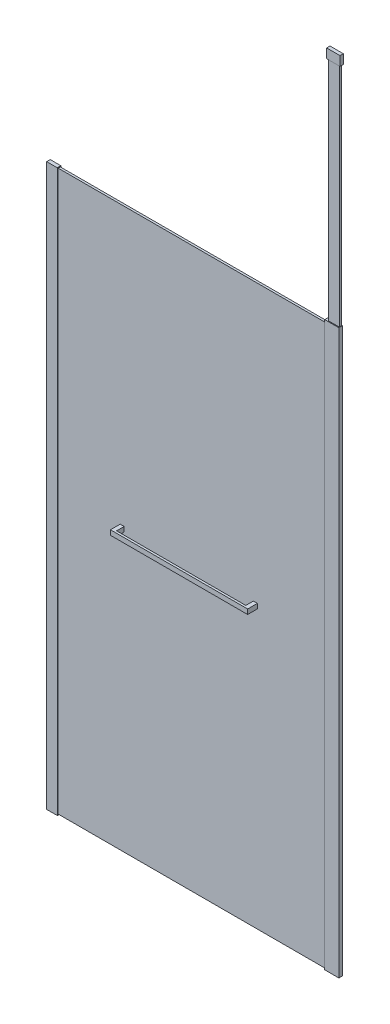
SolidWorks part; units mm, degrees
ref_plane "Płaszczyzna przednia" through (0, 0, 0) normal (0, 0, 1) x (1, 0, 0)
ref_plane "Płaszczyzna górna" through (0, 0, 0) normal (0, 1, 0) x (1, 0, 0)
ref_plane "Płaszczyzna prawa" through (0, 0, 0) normal (1, 0, 0) x (0, 0, -1)
sketch "Szkic1" plane through (0, 0, 0) normal (0, 1, 0) x (1, 0, 0)
  line L0 (0, 0) -> (0, 13.3)
  line L1 (0, 13.3) -> (40, 13.3)
  line L2 (40, 13.3) -> (40, 11.4)
  line L3 (40, 11.4) -> (6.5, 11.4)
  line L4 (6.5, 11.4) -> (6.5, 3.4)
  line L5 (6.5, 3.4) -> (40, 3.4)
  line L6 (40, 3.4) -> (40, 0)
  line L7 (40, 0) -> (0, 0)
  dimension "D1" = 40
  dimension "D2" = 13.3
  dimension "D3" = 33.5
  dimension "D4" = 1.9
  dimension "D5" = 8
extrude "Dodanie-wyciągnięcie1" add sketch "Szkic1" along normal blind 2100 from offset 3
sketch "Szkic2" plane through (0, 3, 0) normal (0, -1, 0) x (1, 0, 0)
  line L0 (6.5, -11.4) -> (40, -11.4) construction
  line L1 (6.5, -3.4) -> (1053.5, -3.4)
  line L2 (6.5, -3.4) -> (6.5, -11.4)
  line L3 (6.5, -11.4) -> (1053.5, -11.4)
  line L4 (1053.5, -3.4) -> (1053.5, -11.4)
  dimension "D1" = 1047
extrude "Dodanie-wyciągnięcie2" add sketch "Szkic2" against normal blind 2100 separate body
sketch "Szkic3" plane through (0, 3, 0) normal (0, -1, 0) x (1, 0, 0)
  line L0 (1043.4, -3.4) -> (1043.4, -0.4)
  line L1 (1053.5, -3.4) -> (6.5, -3.4) construction
  line L2 (1043.4, -0.4) -> (1096.4, -0.4)
  line L3 (1096.4, -0.4) -> (1096.4, -14.4)
  line L4 (1096.4, -14.4) -> (1043.4, -14.4)
  line L5 (1043.4, -14.4) -> (1043.4, -11.4)
  line L6 (1043.4, -11.4) -> (1053.5, -11.4)
  line L7 (1053.5, -11.4) -> (1053.5, -3.4)
  line L8 (1053.5, -3.4) -> (1043.4, -3.4)
  line L9 (6.5, -11.4) -> (1053.5, -11.4) construction
  line L10 (1053.5, -11.4) -> (1053.5, -3.4) construction
  dimension "D1" = 10.1
  dimension "D2" = 3
  dimension "D3" = 3
  dimension "D4" = 53
extrude "Dodanie-wyciągnięcie3" add sketch "Szkic3" against normal blind 2108 separate body
sketch "Szkic4" plane through (0, 2103, 0) normal (0, 1, 0) x (1, 0, 0)
  line L1 (0, 13.3) -> (40, 13.3)
  line L2 (0, 13.3) -> (0, 0)
  line L3 (0, 0) -> (40, 0)
  line L4 (40, 13.3) -> (40, 0)
extrude "Dodanie-wyciągnięcie4" add sketch "Szkic4" along normal blind 3
sketch "Szkic5" plane through (0, 2111, 0) normal (0, 1, 0) x (1, 0, 0)
  line L1 (1096.4, 14.4) -> (1043.4, 14.4)
  line L2 (1096.4, 14.4) -> (1096.4, 0.4)
  line L3 (1096.4, 0.4) -> (1043.4, 0.4)
  line L4 (1043.4, 14.4) -> (1043.4, 0.4)
extrude "Dodanie-wyciągnięcie5" add sketch "Szkic5" along normal blind 3
sketch "Szkic6" plane through (1043.4, 0, 0) normal (-1, 0, 0) x (0, 0, 1)
  line L0 (-11.4, 2111) -> (-3.4, 2111) construction
  line L1 (-3.35, 2111) -> (-11.45, 2111)
  line L2 (-3.35, 2111) -> (-3.35, 2103.2)
  line L3 (-3.35, 2103.2) -> (-11.45, 2103.2)
  line L4 (-11.45, 2111) -> (-11.45, 2103.2)
  point P6 (-7.4, 2111)
  dimension "D1" = 8.1
  dimension "D2" = 7.8
extrude "Dodanie-wyciągnięcie6" add sketch "Szkic6" against normal blind 15
sketch "Szkic7" plane through (0, 3, 0) normal (0, -1, 0) x (1, 0, 0)
  line L1 (1043.4, -0.4) -> (1096.4, -0.4)
  line L2 (1043.4, -0.4) -> (1043.4, -14.4)
  line L3 (1043.4, -14.4) -> (1096.4, -14.4)
  line L4 (1096.4, -0.4) -> (1096.4, -14.4)
extrude "Dodanie-wyciągnięcie7" add sketch "Szkic7" along normal blind 3
sketch "Szkic8" plane through (0, 3, 0) normal (0, -1, 0) x (1, 0, 0)
  line L1 (0, 0) -> (40, 0)
  line L2 (0, 0) -> (0, -13.3)
  line L3 (0, -13.3) -> (40, -13.3)
  line L4 (40, 0) -> (40, -13.3)
extrude "Dodanie-wyciągnięcie8" add sketch "Szkic8" along normal blind 3
sketch "Szkic9" plane through (0, 2114, 2099.6) normal (0, -1, 0) x (-1, 0, 0)
  line L1 (-1094.9, 2111) -> (-1054.9, 2111)
  line L2 (-1094.9, 2111) -> (-1094.9, 2103)
  line L3 (-1094.9, 2103) -> (-1054.9, 2103)
  line L4 (-1054.9, 2111) -> (-1054.9, 2103)
  line L7 (-1043.4, 2114) -> (-1096.4, 2114) construction
  line L8 (-1096.4, 2114) -> (-1096.4, 2100) construction
  dimension "D1" = 3
  dimension "D2" = 1.5
  dimension "D3" = 8
  dimension "D4" = 40
extrude "Dodanie-wyciągnięcie9" add sketch "Szkic9" against normal blind 883 separate body
sketch "Szkic10" plane through (0, 2997, 0) normal (0, 1, 0) x (-1, 0, 0)
  line L0 (-1074.9, -11.4) -> (-1074.9, -7.4) construction
  line L1 (-1099.9, -1.15) -> (-1049.9, -1.15)
  line L2 (-1099.9, -1.15) -> (-1099.9, -13.65)
  line L3 (-1099.9, -13.65) -> (-1049.9, -13.65)
  line L4 (-1049.9, -1.15) -> (-1049.9, -13.65)
  line L5 (-1099.9, -1.15) -> (-1049.9, -13.65) construction
  line L6 (-1099.9, -13.65) -> (-1049.9, -1.15) construction
  line L7 (-1054.9, -11.4) -> (-1094.9, -11.4) construction
  line L8 (-1074.9, -7.4) -> (-1094.9, -7.4) construction
  line L9 (-1094.9, -11.4) -> (-1094.9, -3.4) construction
  point P0 (-1074.9, -7.4)
  dimension "D1" = 12.5
  dimension "D2" = 50
extrude "Dodanie-wyciągnięcie10" add sketch "Szkic10" along normal blind 35 from offset 32
ref_plane "Płaszczyzna1" through (1074.9, 0, 0) normal (1, 0, 0) x (0, 0, -1)
sketch "Szkic12" plane through (0, 0, -3.4) normal (0, 0, 1) x (1, 0, 0)
  line L0 (530, 1409.7928) -> (530, 762.3594) construction
  line L1 (280, 1053) -> (780, 1053) construction
  line L2 (6.5, 2103) -> (6.5, 3) construction
  line L3 (1053.5, 2103) -> (1053.5, 3) construction
  line L5 (272.5, 1062) -> (287.5, 1062)
  line L6 (272.5, 1062) -> (272.5, 1044)
  line L7 (272.5, 1044) -> (287.5, 1044)
  line L8 (287.5, 1062) -> (287.5, 1044)
  line L9 (272.5, 1062) -> (287.5, 1044) construction
  line L10 (272.5, 1044) -> (287.5, 1062) construction
  line L11 (772.5, 1062) -> (787.5, 1062)
  line L12 (772.5, 1062) -> (772.5, 1044)
  line L13 (772.5, 1044) -> (787.5, 1044)
  line L14 (787.5, 1062) -> (787.5, 1044)
  line L15 (772.5, 1062) -> (787.5, 1044) construction
  line L16 (772.5, 1044) -> (787.5, 1062) construction
  dimension "D1" = 1053
  dimension "D2" = 500
  dimension "D3" = 15
  dimension "D4" = 18
extrude "Dodanie-wyciągnięcie11" add sketch "Szkic12" along normal blind 36.5 and the other way blind 18 separate body
sketch "Szkic13" plane through (287.5, 0, 0) normal (1, 0, 0) x (0, 0, -1)
  line L0 (21.4, 1044) -> (-33.1, 1044) construction
  line L1 (-33.1, 1062) -> (-25.1, 1062)
  line L2 (-33.1, 1062) -> (-33.1, 1044)
  line L3 (-33.1, 1044) -> (-25.1, 1044)
  line L4 (-25.1, 1062) -> (-25.1, 1044)
  dimension "D1" = 8
extrude "Dodanie-wyciągnięcie12" add sketch "Szkic13" along normal up to surface (485 mm away)
